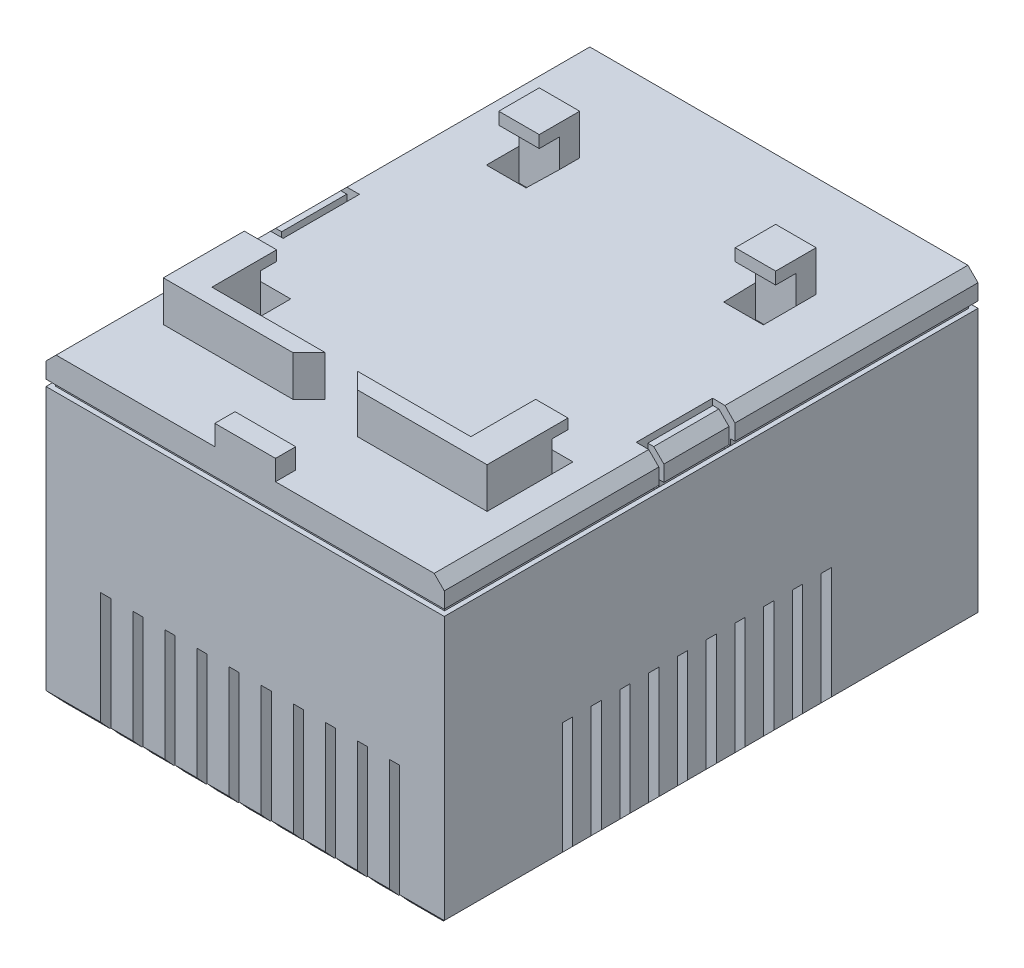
SolidWorks part; units mm, degrees
other "LUMP1"
ref_plane "Спереди" through (0, 0, 0) normal (0, 0, 1) x (1, 0, 0)
ref_plane "Сверху" through (0, 0, 0) normal (0, 1, 0) x (1, 0, 0)
ref_plane "Справа" through (0, 0, 0) normal (1, 0, 0) x (0, 0, -1)
imported_body "Импортированный1"
sketch "Эскиз1" plane through (25, 0, 0) normal (1, 0, 0) x (0, 0, -1)
  line L0 (-65.8434, -19.94) -> (-67, -18.67)
  line L1 (-58.999, -19.94) -> (-67, -19.94) construction
  line L2 (-67, -18.67) -> (-67.9766, -18.67)
  line L3 (-67.9766, -18.67) -> (-67.9766, -20.433)
  line L4 (-67.9766, -20.433) -> (-65.8434, -20.433)
  line L5 (-65.8434, -20.433) -> (-65.8434, -19.94)
  line L6 (-67, -18.67) -> (-67, 17.17) construction
extrude "Вырез-Вытянуть1" cut sketch "Эскиз1" against normal up to surface (50 mm away)
sketch "Эскиз2" plane through (0, -22.226, 0) normal (0, -1, 0) x (1, 0, 0)
  circle A0 centre (-10, 50.109) radius 4.8699
  circle A1 centre (-10, 50.109) radius 4.5414
  circle A2 centre (11.8767, 50.109) radius 4.8744
  circle A3 centre (11.8767, 50.109) radius 4.5621
extrude "Вырез-Вытянуть2" cut sketch "Эскиз2" against normal blind 2
sketch "Эскиз3" plane through (0, -22.226, 0) normal (0, -1, 0) x (1, 0, 0)
  line L0 (-8.0201, 51.1697) -> (-11.0607, 48.1291)
  line L1 (-11.0607, 48.1291) -> (-11.9799, 49.0483)
  line L2 (-11.9799, 49.0483) -> (-8.9393, 52.0889)
  line L3 (-8.9393, 52.0889) -> (-8.0201, 51.1697)
  line L4 (13.5284, 51.6311) -> (11.3449, 47.9268)
  line L5 (11.3449, 47.9268) -> (10.225, 48.5869)
  line L6 (10.225, 48.5869) -> (12.4085, 52.2912)
  line L7 (12.4085, 52.2912) -> (13.5284, 51.6311)
  point P2 (-10, 50.109)
  point P5 (11.8767, 50.109)
  dimension "D1" = 4.3
  dimension "D2" = 1.3
  dimension "D3" = 0.65
  dimension "D4" = 2.15
  dimension "D5" = 1.3
  dimension "D6" = 2.15
  dimension "D7" = 4.3
  dimension "D8" = 0.65
extrude "Вырез-Вытянуть3" cut sketch "Эскиз3" against normal blind 2
sketch "Эскиз4" plane through (0, -15.34, 0) normal (0, -1, 0) x (1, 0, 0)
  circle A0 centre (-11.43, 9.525) radius 1.7849
  circle A1 centre (-11.43, 9.525) radius 1.669
  point P0 (-11.43, 9.525)
extrude "Вырез-Вытянуть4" cut sketch "Эскиз4" against normal blind 2
sketch "Эскиз5" plane through (0, -15.34, 0) normal (0, -1, 0) x (1, 0, 0)
  line L0 (-10.1532, 10.7545) -> (-12.8801, 8.5051)
  line L1 (-12.8801, 8.5051) -> (-12.7247, 8.2963)
  line L2 (-12.7247, 8.2963) -> (-9.9775, 10.5624)
  line L3 (-9.9775, 10.5624) -> (-10.1532, 10.7545)
  circle A2 centre (-11.43, 9.525) radius 1.7849 construction
  circle A3 centre (-11.43, 9.525) radius 1.7849 construction
extrude "Вырез-Вытянуть5" cut sketch "Эскиз5" against normal blind 2
pattern_linear "Линейный массив1" count 6 spacing 4.75 along (1, 0, 0) of "Вырез-Вытянуть4", "Вырез-Вытянуть5"
sketch "Эскиз6" plane through (0, 0, 0) normal (0, 0, -1) x (-1, 0, 0)
  line L0 (25, 17.17) -> (25, -18.67) construction
  line L1 (19, -15.94) -> (17, -15.94)
  line L2 (19, -15.94) -> (19, 8.06)
  line L3 (19, 8.06) -> (17, 8.06)
  line L4 (17, -15.94) -> (17, 8.06)
  line L5 (16, -15.94) -> (14, -15.94)
  line L6 (16, -15.94) -> (16, -1.94)
  line L7 (16, -1.94) -> (14, -1.94)
  line L8 (14, -15.94) -> (14, -1.94)
  line L9 (23.73, -19.94) -> (-23.73, -19.94) construction
  line L10 (-25, -18.67) -> (-25, 17.17) construction
  line L11 (-17, -15.94) -> (-19, -15.94)
  line L12 (-17, -15.94) -> (-17, 8.06)
  line L13 (-17, 8.06) -> (-19, 8.06)
  line L14 (-19, -15.94) -> (-19, 8.06)
  line L15 (-22.46, -19.94) -> (-19.405, -19.94) construction
  line L16 (13, -15.94) -> (11, -15.94)
  line L17 (13, -15.94) -> (13, -1.94)
  line L18 (13, -1.94) -> (11, -1.94)
  line L19 (11, -15.94) -> (11, -1.94)
  line L20 (10, -15.94) -> (8, -15.94)
  line L21 (10, -15.94) -> (10, -1.94)
  line L22 (10, -1.94) -> (8, -1.94)
  line L23 (8, -15.94) -> (8, -1.94)
  line L24 (7, -15.94) -> (5, -15.94)
  line L25 (7, -15.94) -> (7, -1.94)
  line L26 (7, -1.94) -> (5, -1.94)
  line L27 (5, -15.94) -> (5, -1.94)
  line L28 (4, -15.94) -> (2, -15.94)
  line L29 (4, -15.94) -> (4, -1.94)
  line L30 (4, -1.94) -> (2, -1.94)
  line L31 (2, -15.94) -> (2, -1.94)
  line L32 (1, -15.94) -> (-1, -15.94)
  line L33 (1, -15.94) -> (1, -1.94)
  line L34 (1, -1.94) -> (-1, -1.94)
  line L35 (-1, -15.94) -> (-1, -1.94)
  line L36 (-2, -15.94) -> (-4, -15.94)
  line L37 (-2, -15.94) -> (-2, -1.94)
  line L38 (-2, -1.94) -> (-4, -1.94)
  line L39 (-4, -15.94) -> (-4, -1.94)
  line L40 (-5, -15.94) -> (-7, -15.94)
  line L41 (-5, -15.94) -> (-5, -1.94)
  line L42 (-5, -1.94) -> (-7, -1.94)
  line L43 (-7, -15.94) -> (-7, -1.94)
  line L44 (-8, -15.94) -> (-10, -15.94)
  line L45 (-8, -15.94) -> (-8, -1.94)
  line L46 (-8, -1.94) -> (-10, -1.94)
  line L47 (-10, -15.94) -> (-10, -1.94)
  line L48 (-11, -15.94) -> (-13, -15.94)
  line L49 (-11, -15.94) -> (-11, -1.94)
  line L50 (-11, -1.94) -> (-13, -1.94)
  line L51 (-13, -15.94) -> (-13, -1.94)
  line L52 (-14, -15.94) -> (-16, -15.94)
  line L53 (-14, -15.94) -> (-14, -1.94)
  line L54 (-14, -1.94) -> (-16, -1.94)
  line L55 (-16, -15.94) -> (-16, -1.94)
  dimension "D1" = 2
  dimension "D2" = 6
  dimension "D3" = 1
  dimension "D4" = 2
  dimension "D5" = 10
  dimension "D6" = 4
  dimension "D7" = 2
  dimension "D8" = 6
  dimension "D9" = 24
  dimension "D10" = 24
  dimension "D11" = 4
  dimension "D12" = 11
extrude "Вырез-Вытянуть6" cut sketch "Эскиз6" against normal blind 2
sketch "Эскиз8" plane through (0, 18.44, 0) normal (0, 1, 0) x (1, 0, 0)
  line L0 (0, -67) -> (0, -40.3835) construction
  line L1 (3.81, -67) -> (-3.81, -67) construction
  line L2 (-25, -40.0668) -> (-22.1658, -40.0668)
  line L3 (-22.1658, -40.0668) -> (-22.1658, -30.4778)
  line L4 (-22.1658, -30.4778) -> (-25, -30.5109)
  line L5 (-25, -30.5109) -> (-25, -31.2599)
  line L6 (-25, 0) -> (-25, -67) construction
  line L7 (-25, -31.2599) -> (-22.9834, -31.2599)
  line L8 (-22.9834, -31.2599) -> (-22.9834, -39.434)
  line L9 (-22.9834, -39.434) -> (-25, -39.434)
  line L10 (-25, -39.434) -> (-25, -40.0668)
  line L11 (25, -39.434) -> (25, -40.0668)
  line L12 (22.9834, -39.434) -> (25, -39.434)
  line L13 (22.9834, -31.2599) -> (22.9834, -39.434)
  line L14 (25, -31.2599) -> (22.9834, -31.2599)
  line L15 (25, -30.5109) -> (25, -31.2599)
  line L16 (22.1658, -30.4778) -> (25, -30.5109)
  line L17 (22.1658, -40.0668) -> (22.1658, -30.4778)
  line L18 (25, -40.0668) -> (22.1658, -40.0668)
extrude "Вырез-Вытянуть7" cut sketch "Эскиз8" against normal blind 4
sketch "Эскиз9" plane through (0, 18.44, 0) normal (0, 1, 0) x (1, 0, 0)
  line L0 (-20.32, -48.822) -> (-20.32, -46.1692)
  line L1 (-20.32, -46.1692) -> (-15.1073, -46.1692)
  line L2 (-15.1073, -46.1692) -> (-15.1073, -54.0423)
  line L3 (-15.1073, -54.0423) -> (-11.257, -54.0423)
  line L4 (-11.257, -54.0423) -> (-11.257, -54.918)
  line L5 (-2.032, -54.918) -> (-16.256, -54.918) construction
  line L6 (-11.257, -54.918) -> (-16.256, -54.918)
  line L7 (-16.256, -54.918) -> (-16.256, -48.822)
  line L8 (-16.256, -46.79) -> (-16.256, -54.918) construction
  line L9 (-16.256, -48.822) -> (-16.256, -54.918) construction
  line L10 (-16.256, -48.822) -> (-20.32, -48.822)
  line L11 (-17.38, -15.24) -> (-17.38, -19.3318)
  line L12 (-17.38, -12.7) -> (-17.38, -17.78) construction
  line L13 (-17.38, -19.3318) -> (-12.4063, -19.3318)
  line L14 (-12.4063, -19.3318) -> (-12.3, -15.24)
  line L15 (-12.3, -17.78) -> (-12.3, -12.7) construction
  line L16 (-12.3, -15.24) -> (-17.38, -15.24)
  line L17 (0, -28.0094) -> (0, -35.7101) construction
  line L18 (12.3, -15.24) -> (17.38, -15.24)
  line L19 (12.4063, -19.3318) -> (12.3, -15.24)
  line L20 (17.38, -19.3318) -> (12.4063, -19.3318)
  line L21 (17.38, -15.24) -> (17.38, -19.3318)
  line L22 (16.256, -48.822) -> (20.32, -48.822)
  line L23 (16.256, -54.918) -> (16.256, -48.822)
  line L24 (11.257, -54.918) -> (16.256, -54.918)
  line L25 (11.257, -54.0423) -> (11.257, -54.918)
  line L26 (15.1073, -54.0423) -> (11.257, -54.0423)
  line L27 (15.1073, -46.1692) -> (15.1073, -54.0423)
  line L28 (20.32, -46.1692) -> (15.1073, -46.1692)
  line L29 (20.32, -48.822) -> (20.32, -46.1692)
extrude "Вырез-Вытянуть8" cut sketch "Эскиз9" against normal blind 4
sketch "Эскиз10" plane through (0, 0, 67) normal (0, 0, 1) x (1, 0, 0)
  line L0 (0, 18.2476) -> (0, 10.6387) construction
  line L1 (-25.7329, 15.1829) -> (-24.4119, 15.1829)
  line L2 (-25.7329, 15.1829) -> (-25.7329, 14.3903)
  line L3 (-25.7329, 14.3903) -> (-24.4119, 14.3903)
  line L4 (-24.4119, 15.1829) -> (-24.4119, 14.3903)
  line L5 (24.4119, 15.1829) -> (24.4119, 14.3903)
  line L6 (25.7329, 14.3903) -> (24.4119, 14.3903)
  line L7 (25.7329, 15.1829) -> (25.7329, 14.3903)
  line L8 (25.7329, 15.1829) -> (24.4119, 15.1829)
extrude "Вырез-Вытянуть9" cut sketch "Эскиз10" against normal up to surface (67 mm away)
sketch "Эскиз11" plane through (-25, 0, 0) normal (-1, 0, 0) x (0, 0, 1)
  line L0 (0, 14.3903) -> (67, 14.3903) construction
  line L1 (-0.5195, 15.1828) -> (0.6338, 15.1828)
  line L2 (-0.5195, 15.1828) -> (-0.5195, 14.3903)
  line L3 (-0.5195, 14.3903) -> (0.6338, 14.3903)
  line L4 (0.6338, 15.1828) -> (0.6338, 14.3903)
  line L5 (40.0668, 15.1829) -> (67, 15.1829) construction
  line L7 (66.373, 15.1829) -> (67.4331, 15.1829)
  line L8 (66.373, 15.1829) -> (66.373, 14.3903)
  line L9 (66.373, 14.3903) -> (67.4331, 14.3903)
  line L10 (67.4331, 15.1829) -> (67.4331, 14.3903)
extrude "Вырез-Вытянуть10" cut sketch "Эскиз11" against normal up to surface (50 mm away)
